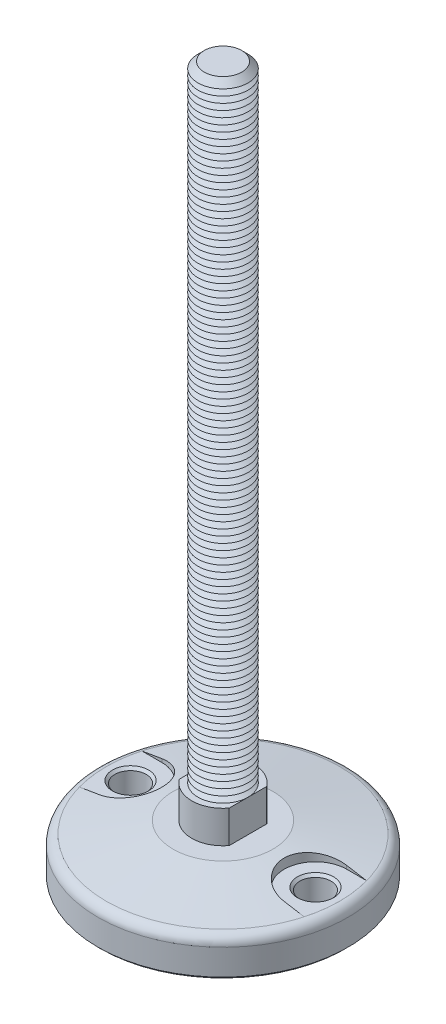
SolidWorks part; units mm, degrees
ref_plane "Front Plane" through (0, 0, 0) normal (0, 0, 1) x (1, 0, 0)
ref_plane "Top Plane" through (0, 0, 0) normal (0, 1, 0) x (1, 0, 0)
ref_plane "Right Plane" through (0, 0, 0) normal (1, 0, 0) x (0, 0, -1)
sketch "Sketch1" plane through (0, 0, 0) normal (1, 0, 0) x (0, 0, -1)
  line L0 (0, 61.3389) -> (0, -58.404) construction
sketch "Sketch2" plane through (0, 0, 0) normal (1, 0, 0) x (0, 0, -1)
  line L0 (0, 0) -> (-20, 0)
  line L1 (-20, 0) -> (-50, -5.2898)
  line L2 (-50, -5.2898) -> (-50, -20)
  line L3 (-50, -20) -> (0, -20)
  line L4 (0, 61.3389) -> (0, -58.404) construction
  line L5 (0, -20) -> (0, 0)
  dimension "D1" = 20
  dimension "D2" = 50
  dimension "D3" = 20
  dimension "D4" = 10
revolve "Revolve1" add sketch "Sketch2" angle 360 about L0
fillet "Fillet1" radius 4 1 edges at (0, -5.2898, 50)
sketch "Sketch3" plane through (0, 0, 0) normal (0, 1, 0) x (1, 0, 0)
  circle A0 centre (0, 0) radius 12.5
  dimension "D1" = 25
extrude "Boss-Extrude1" add sketch "Sketch3" along normal blind 13
sketch "Sketch4" plane through (0, 13, 0) normal (0, 1, 0) x (1, 0, 0)
  line L0 (-10, 7.5) -> (-10, -7.5)
  line L2 (10, -7.5) -> (10, 7.5)
  arc A0 (-10, 7.5) -> (-10, -7.5) centre (0, 0) ccw
  circle A1 centre (0, 0) radius 12.5 construction
  arc A2 (10, -7.5) -> (10, 7.5) centre (0, 0) ccw
  dimension "D1" = 20
extrude "Cut-Extrude1" cut sketch "Sketch4" against normal blind 13
sketch "Sketch5" plane through (0, 13, 0) normal (0, 1, 0) x (1, 0, 0)
  circle A0 centre (0, 0) radius 10
  dimension "D1" = 20
extrude "Boss-Extrude2" add sketch "Sketch5" along normal blind 250
chamfer "Chamfer1" distance 2.5 angle 45 1 edges at (0, 263, 10)
sketch "Sketch6" plane through (0, 0, 0) normal (1, 0, 0) x (0, 0, -1)
  line L0 (-10, 13) -> (-7.8349, 14.25)
  line L1 (-7.8349, 14.25) -> (-10, 15.5)
  line L2 (-10, 260.5) -> (-10, 13) construction
  line L3 (-10, 15.5) -> (-10, 13)
  dimension "D1" = 2.5
revolve "Cut-Revolve1" cut sketch "Sketch6" angle 360 about L0
pattern_linear "LPattern1" count 99 spacing 2.5 along (0, 1, 0) of "Cut-Revolve1"
sketch "Sketch8" plane through (0, 0, 0) normal (0, 1, 0) x (1, 0, 0)
  line L0 (-37, 12.5) -> (-44.9904, 12.5)
  line L1 (-37, -12.5) -> (-44.9904, -12.5)
  arc A1 (-44.9904, 12.5) -> (-44.9904, -12.5) centre (0, 0) ccw
  circle A2 centre (0, 0) radius 46.6946 construction
  arc A3 (-37, -12.5) -> (-37, 12.5) centre (-37, 0) ccw
  point P3 (-37, 0)
  point P11 (0, 0)
  dimension "D1" = 37
  dimension "D2" = 25
extrude "Cut-Extrude4" cut sketch "Sketch8" against normal blind 4.7
sketch "Sketch10" plane through (0, -4.7, 0) normal (0, 1, 0) x (1, 0, 0)
  circle A0 centre (-37, 0) radius 6.25
  dimension "D1" = 12.5
extrude "Cut-Extrude5" cut sketch "Sketch10" against normal up to surface (15.3 mm away)
chamfer "Chamfer2" distance 1 angle 45 2 edges at (-37, -20, -6.25) (-37, -4.7, 6.25)
mirror "Mirror1" about plane through (0, 0, 0) normal (1, 0, 0) of "Chamfer2", "Cut-Extrude5", "Cut-Extrude4"
chamfer "Chamfer3" distance 1 angle 45 1 edges at (0, -20, 50)
